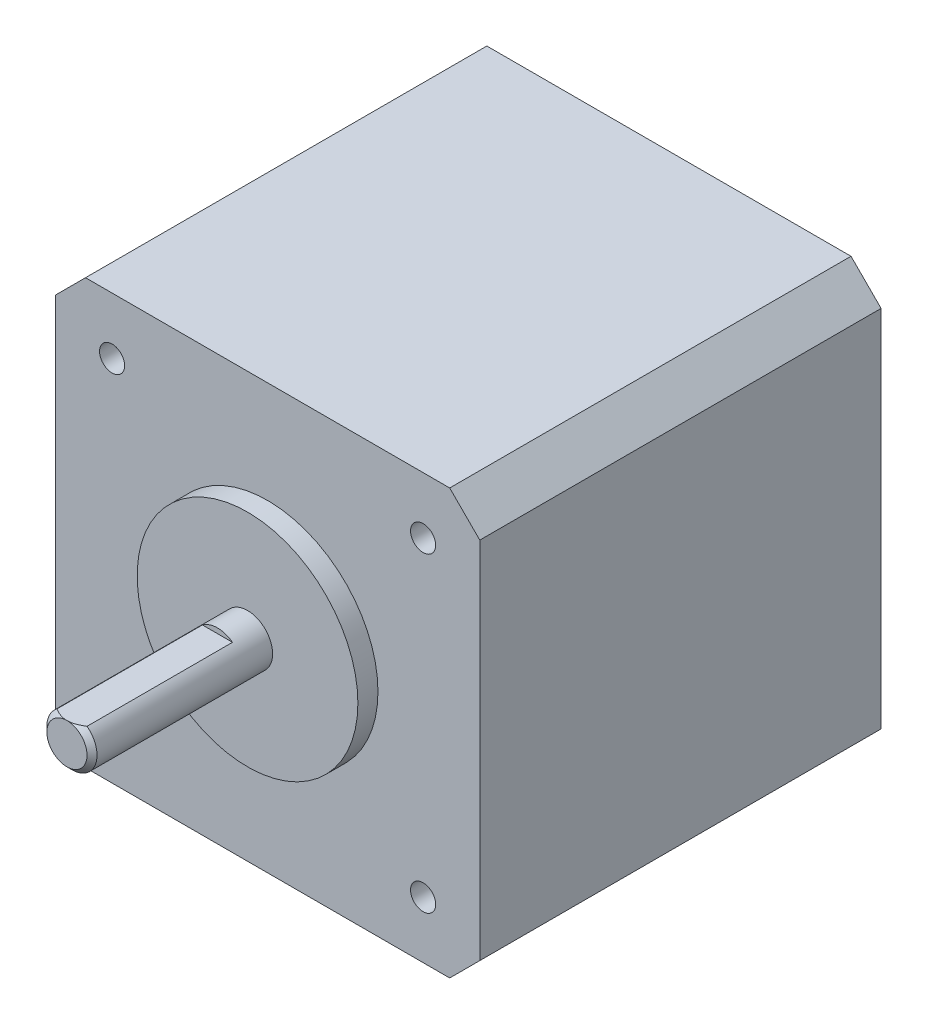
SolidWorks part; units mm, degrees
ref_plane "前视基准面" through (0, 0, 0) normal (0, 0, 1) x (1, 0, 0)
ref_plane "上视基准面" through (0, 0, 0) normal (0, 1, 0) x (1, 0, 0)
ref_plane "右视基准面" through (0, 0, 0) normal (1, 0, 0) x (0, 0, -1)
sketch "草图1" plane through (0, 0, 0) normal (0, 0, 1) x (1, 0, 0)
  circle A0 centre (0, 0) radius 11
extrude "凸台-拉伸1" add sketch "草图1" against normal blind 2
sketch "草图2" plane through (0, 0, 0) normal (0, 0, 1) x (1, 0, 0)
  circle A0 centre (0, 0) radius 2.5
extrude "凸台-拉伸2" add sketch "草图2" along normal blind 18
sketch "草图3" plane through (0, 0, 18) normal (0, 0, 1) x (1, 0, 0)
  line L1 (0, 2) -> (2.8558, 2)
  line L2 (2.8558, 2) -> (2.8558, 3.4127)
  line L3 (2.8558, 3.4127) -> (-2.5, 3.4127)
  line L4 (-2.5, 3.4127) -> (-2.5, 2)
  line L5 (-2.5, 2) -> (0, 2)
extrude "切除-拉伸1" cut sketch "草图3" against normal blind 15
chamfer "倒角1" distance 0.5 angle 45 1 edges at (0, -2.5, 18)
sketch "草图4" plane through (0, 0, -2) normal (0, 0, -1) x (-1, 0, 0)
  line L0 (-21.15, 18.15) -> (-18.15, 21.15)
  line L1 (0, 21.15) -> (18.15, 21.15)
  line L2 (21.15, 18.15) -> (21.15, -18.15)
  line L3 (18.15, -21.15) -> (-18.15, -21.15)
  line L4 (-21.15, -18.15) -> (-21.15, 18.15)
  line L5 (-18.15, 21.15) -> (0, 21.15)
  line L6 (18.15, 21.15) -> (21.15, 18.15)
  line L7 (21.15, -18.15) -> (18.15, -21.15)
  line L8 (-18.15, -21.15) -> (-21.15, -18.15)
  point P3 (21.15, 21.15)
  point P4 (21.15, -21.15)
  point P5 (-21.15, -21.15)
  point P6 (-21.15, 21.15)
extrude "凸台-拉伸3" add sketch "草图4" along normal blind 40
sketch "草图5" plane through (0, 0, -2) normal (0, 0, 1) x (1, 0, 0)
  point P8 (-15.5, 15.5)
  point P9 (15.5, 15.5)
  point P10 (15.5, -15.5)
  point P11 (-15.5, -15.5)
hole_wizard "M3 螺纹孔1" positions "草图7" profile "草图6" tap size "M3" standard "GB"
sketch "草图7" plane through (0, 0, -2) normal (0, 0, 1) x (1, 0, 0)
  point P0 (-15.5, 15.5)
  point P3 (15.5, 15.5)
  point P6 (15.5, -15.5)
  point P9 (-15.5, -15.5)
sketch "草图6" plane through (-15.5, 15.5, -2) normal (1, 0, 0) x (0, -1, 0)
  line L0 (0, 0) -> (0, 7.7511)
  line L1 (0, 7.7511) -> (1.25, 7)
  line L2 (1.25, 7) -> (1.25, 0)
  line L5 (1.25, 0) -> (0, 0)
  line L10 (0, 7.7511) -> (-1.25, 7) construction
  line L11 (0, -6.35) -> (0, 107.95) construction
  dimension "螺纹孔钻头直径" = 2.5
  dimension "螺纹孔钻头深度" = 7
  dimension "导头角度" = 118
